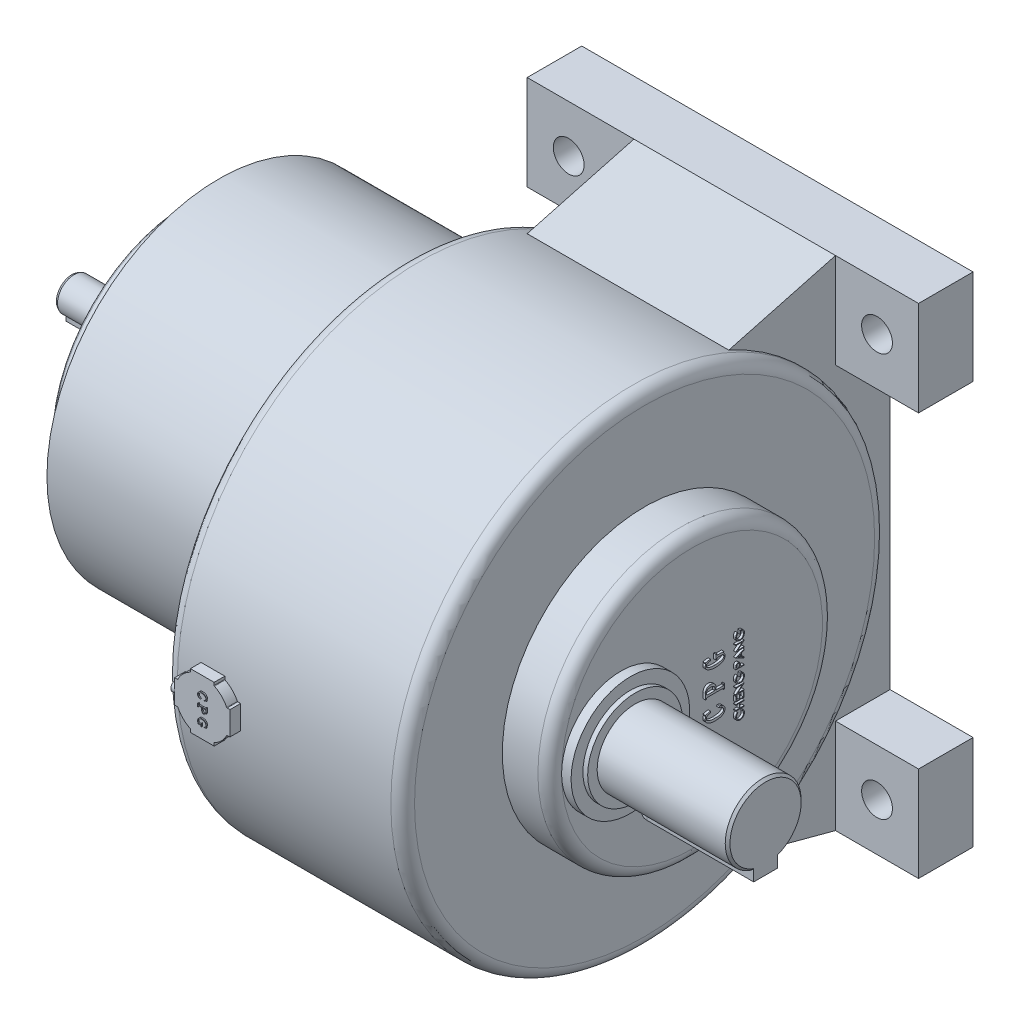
SolidWorks part; units mm, degrees
ref_plane "前视基准面" through (0, 0, 0) normal (0, 0, 1) x (1, 0, 0)
ref_plane "上视基准面" through (0, 0, 0) normal (0, 1, 0) x (1, 0, 0)
ref_plane "右视基准面" through (0, 0, 0) normal (1, 0, 0) x (0, 0, -1)
ref_plane "基准面1" through (0, 0, -140) normal (0, 0, 1) x (1, 0, 0)
sketch "草图1" plane through (0, 0, 0) normal (0, 1, 0) x (1, 0, 0)
  line L0 (0, 0) -> (33.1729, 0) construction
  line L1 (0, 0) -> (0, -16)
  line L2 (0, -16) -> (-55, -16)
  line L3 (-55, -16) -> (-55, -20)
  line L4 (-55, -20) -> (-57, -20)
  line L5 (-57, -20) -> (-57, -25)
  line L6 (-57, -25) -> (-61, -25)
  line L7 (-61, -25) -> (-61, 0)
  line L8 (-61, 0) -> (0, 0)
  dimension "D1" = 55
  dimension "D2" = 32
  dimension "D3" = 40
  dimension "D4" = 2
  dimension "D5" = 50
  dimension "D6" = 4
revolve "旋转1" add sketch "草图1" angle 360 about L0
sketch "草图2" plane through (0, 0, 0) normal (0, 1, 0) x (1, 0, 0)
  line L0 (8.0167, 30) -> (-61, 30) construction
  line L1 (-61, 30) -> (-61, -30)
  line L2 (-61, 25) -> (-61, -25) construction
  line L3 (-61, -30) -> (-81, -30)
  line L4 (-81, -30) -> (-81, -72)
  line L5 (-81, -72) -> (-181, -72)
  line L6 (-181, -72) -> (-181, 30)
  line L11 (-61, 30) -> (-181, 30)
  line L13 (-103.125, 140) -> (103.125, 140) construction
  dimension "D1" = 30
  dimension "D2" = 120
  dimension "D3" = 20
  dimension "D4" = 212
  dimension "D5" = 100
revolve "旋转2" add sketch "草图2" angle 360 about L0
sketch "草图3" plane through (0, 0, -140) normal (0, 0, 1) x (1, 0, 0)
  line L0 (0, 0) -> (40.0459, 0) construction
  line L1 (-217.5, -65) -> (-52.5, -65)
  line L2 (-217.5, -65) -> (-217.5, -105)
  line L3 (-217.5, -105) -> (-52.5, -105)
  line L4 (-52.5, -65) -> (-52.5, -105)
  line L5 (0, -16) -> (0, 16) construction
  circle A0 centre (-70, -85) radius 6.5
  circle A1 centre (-200, -85) radius 6.5
  dimension "D2" = 170
  dimension "D3" = 13
  dimension "D4" = 130
  dimension "D6" = 70
  dimension "D8" = 40
  dimension "D1" = 210
  dimension "D5" = 165
  dimension "D7" = 17.5
extrude "拉伸2" add sketch "草图3" along normal blind 23
mirror "镜向2" about plane through (0, 0, 0) normal (0, 1, 0)
ref_plane "基准面4" through (-130, 0, 0) normal (1, 0, 0) x (0, 0, -1)
sketch "草图4" plane through (-130, 0, 0) normal (1, 0, 0) x (0, 0, -1)
  line L0 (117, 65) -> (140, 65) construction
  line L1 (117, 65) -> (140, 65)
  line L2 (117, 105) -> (117, 65) construction
  line L3 (117, 105) -> (117, 65)
  line L4 (117, -65) -> (140, -65) construction
  line L5 (117, -65) -> (140, -65)
  line L6 (117, -105) -> (117, -65) construction
  line L7 (117, -105) -> (117, -65)
  line L8 (140, 65) -> (140, -65)
  line L9 (117, 105) -> (72, 92.9516)
  line L11 (72, -92.9516) -> (117, -105)
  arc A1 (72, -92.9516) -> (72, 92.9516) centre (30, 0) ccw
  circle A2 centre (30, 0) radius 102 construction
  dimension "D1" = 45
extrude "拉伸3" add sketch "草图4" against normal mid plane 85
sketch "草图5" plane through (0, 0, 0) normal (0, 1, 0) x (1, 0, 0)
  line L0 (0, -5) -> (-45, -5)
  line L1 (0, -16) -> (0, 16) construction
  line L2 (-45, 5) -> (0, 5)
  line L3 (0, 5) -> (0, -5)
  line L4 (35.5, -13.7955) -> (35.5, 19.6443) construction
  arc A0 (-45, -5) -> (-45, 5) centre (-45, 0) cw
  dimension "D2" = 50
  dimension "D1" = 10
  dimension "D3" = 35.5
extrude "拉伸4" add sketch "草图5" against normal blind 19
fillet "圆角1" radius 5 3 edges at (-181, 0, -132) (-81, 0, -132) (-61, 0, -90)
chamfer "倒角1" distance 1 angle 45 1 edges at (0, 16, 0)
ref_plane "BOX ANGLE" through (0, 0, 0) normal (0, 1, 0) x (-1, 0, 0)
sketch "草圖2"
extrude "伸長1" add sketch "草圖2" along normal blind 1
sketch "草圖3" plane through (0, 0, 0) normal (0, 1, 0) x (1, 0, 0)
  line L0 (-529.7318, 47.5) -> (22.6764, 47.5) construction
  line L1 (0, -5) -> (0, 5) construction
  line L4 (-278, -25) -> (-181, -25)
  line L7 (-181, 127) -> (-181, -67) construction
  line L9 (-278, 47.5) -> (-278, -25)
  line L11 (-181, -25) -> (-181, 47.5)
  line L12 (-181, 47.5) -> (-278, 47.5)
  point P2 (0, 0)
  dimension "D1" = 47.5
  dimension "D4" = 145
  dimension "D7" = 97
revolve "旋轉1" add sketch "草圖3" angle 360 about L0
sketch "草圖4" plane through (0, 0, 0) normal (0, 1, 0) x (1, 0, 0)
  line L0 (-316.044, 54.5) -> (-339.044, 54.5)
  line L1 (-339.044, 54.5) -> (-340, 54)
  line L2 (-340, 54) -> (-340, 47.5)
  line L3 (-312.544, 72.7) -> (-312.544, 54.75)
  line L4 (-315, 54.45) -> (-316.044, 54.45)
  line L5 (-315, 54.45) -> (-314.5, 54.75)
  line L6 (-314.5, 54.75) -> (-312.544, 54.75)
  line L7 (-278.5, 105.5) -> (-289.744, 105.5)
  line L8 (-303.8916, 73.5) -> (-311.744, 73.5)
  line L9 (-290.9237, 81.5851) -> (-303.2713, 73.7156)
  line L10 (-390.8099, 47.5) -> (-77.5909, 47.5) construction
  line L11 (-278, 120) -> (-278, -25) construction
  line L12 (0, -5) -> (0, 5) construction
  line L13 (-340, 47.5) -> (-278, 47.5)
  line L14 (-290.544, 104.7) -> (-290.544, 82.3695)
  line L15 (-316.044, 54.5) -> (-316.044, 54.45)
  line L16 (-278, 105) -> (-278, 47.5)
  arc A0 (-311.744, 73.5) -> (-312.544, 72.7) centre (-311.744, 72.7) ccw
  arc A3 (-303.8916, 73.5) -> (-303.2713, 73.7156) centre (-303.8916, 74.5) ccw
  arc A6 (-290.9237, 81.5851) -> (-290.544, 82.3695) centre (-291.544, 82.3695) ccw
  arc A7 (-289.744, 105.5) -> (-290.544, 104.7) centre (-289.744, 104.7) ccw
  arc A8 (-278, 105) -> (-278.5, 105.5) centre (-278.5, 105) ccw
  point P1 (0, 0)
  point P21 (0, 0)
  dimension "D1" = 47.5
  dimension "D2" = 116
  dimension "D3" = 14
  dimension "D4" = 25
  dimension "D5" = 340
revolve "旋轉2" add sketch "草圖4" angle 360 about L10
sketch "草圖5" plane through (0, 0, 0) normal (0, 1, 0) x (1, 0, 0)
  line L0 (-343.4362, 47.5) -> (-313.458, 47.5) construction
  line L2 (-340, 45) -> (-320.5, 45)
  line L3 (-340, 54) -> (-340, 41) construction
  line L4 (-320.5, 50) -> (-340, 50)
  line L5 (-340, 50) -> (-340, 45)
  line L6 (-339.044, 40.5) -> (-316.044, 40.5) construction
  line L7 (-318, 47.5) -> (-318, 36.9604) construction
  arc A0 (-320.5, 45) -> (-320.5, 50) centre (-320.5, 47.5) ccw
  dimension "D1" = 5
  dimension "D2" = 2.5
  dimension "D3" = 7
  dimension "D4" = 22
extrude "伸長2" add sketch "草圖5" against normal blind 9.2
ref_plane "平面1" through (0, 0, 76.5) normal (0, 0, 1) x (1, 0, 0)
sketch "草圖6" plane through (0, 0, 76.5) normal (0, 0, 1) x (1, 0, 0)
  line L0 (-166, 11.65) -> (-156, 11.65)
  line L1 (-166, 11.65) -> (-166, 10.5119)
  line L2 (-156, 11.65) -> (-156, 10.5119)
  line L3 (-166, -10.5119) -> (-166, -11.65)
  line L4 (-156, -10.5119) -> (-156, -11.65)
  line L5 (-172.65, 5) -> (-171.5119, 5)
  line L6 (-172.65, -5) -> (-171.5119, -5)
  line L7 (-172.65, -5) -> (-172.65, 5)
  line L8 (-166, -11.65) -> (-166, -10.5119)
  line L9 (-156, -11.65) -> (-156, -10.5119)
  line L10 (-156, -11.65) -> (-166, -11.65)
  line L11 (-149.35, -5) -> (-150.4881, -5)
  line L12 (-149.35, 5) -> (-150.4881, 5)
  line L13 (-149.35, 5) -> (-149.35, -5)
  arc A0 (-166.1383, 10.2882) -> (-171.2882, 5.1383) centre (-161, 0) ccw
  arc A1 (-166.1383, 10.2882) -> (-166, 10.5119) centre (-166.25, 10.5119) ccw
  arc A2 (-156, 10.5119) -> (-155.8617, 10.2882) centre (-155.75, 10.5119) ccw
  arc A3 (-171.5119, 5) -> (-171.2882, 5.1383) centre (-171.5119, 5.25) ccw
  arc A4 (-171.2882, -5.1383) -> (-171.5119, -5) centre (-171.5119, -5.25) ccw
  arc A5 (-166, -10.5119) -> (-166.1383, -10.2882) centre (-166.25, -10.5119) ccw
  arc A6 (-155.8617, -10.2882) -> (-156, -10.5119) centre (-155.75, -10.5119) ccw
  arc A7 (-150.4881, -5) -> (-150.7118, -5.1383) centre (-150.4881, -5.25) ccw
  arc A8 (-150.7118, 5.1383) -> (-150.4881, 5) centre (-150.4881, 5.25) ccw
  arc A9 (-150.7118, 5.1383) -> (-155.8617, 10.2882) centre (-161, 0) ccw
  arc A10 (-171.2882, -5.1383) -> (-166.1383, -10.2882) centre (-161, 0) ccw
  arc A11 (-155.8617, -10.2882) -> (-150.7118, -5.1383) centre (-161, 0) ccw
  dimension "D1" = 11.5
extrude "伸長3" add sketch "草圖6" against normal blind 4.5 separate body contours A6 A11 A7 L11 L13 L12 A8 A9 A2 L2 L0 L1 A1 A0 A3 L5 L7 L6 A4 A10 A5 L3 L10 L4
sketch "草圖7"
extrude "伸長4" add sketch "草圖7" along normal blind 0.5
sketch "草圖8" plane through (0, 0, 0) normal (0, 1, 0) x (1, 0, 0)
  line L0 (-174.5404, -74.25) -> (-166.5404, -74.25)
  line L1 (-174.5404, -74.25) -> (-174.5404, -72.25)
  line L2 (-173.0404, -73) -> (-173.0404, -72.25)
  line L13 (-171.0404, -73) -> (-166.5404, -73.25)
  line L15 (-173.0404, -73) -> (-171.0404, -73)
  line L23 (-174.5404, -72.25) -> (-173.0404, -72.25)
  line L24 (-171.0404, -74.25) -> (-171.0404, -73)
  line L25 (-166.5404, -74.25) -> (-166.5404, -73.25)
revolve "旋轉3" add sketch "草圖8" angle 360 about L0
equation "\"D7@草图3\" =  ( \"D5@草图3\"-\"D4@草图3\"  )  / 2"
equation "\"D8@草图3\" =  \"D1@草图3\"-\"D2@草图3\""
equation "\"D1@拉伸4\" =\"D3@草图5\"-\"D2@草图1\"/2"
equation "\"D3@草图1\" = \"D2@草图1\"+8"
equation "\"D5@草图2\" = \"D4@草图3\"-30"
equation "\"D1@基准面4\" =\"D5@草图3\"/2-5"
equation "\"D1@拉伸3\" = \"D4@草图3\"-\"D3@草图3\" - 32"
